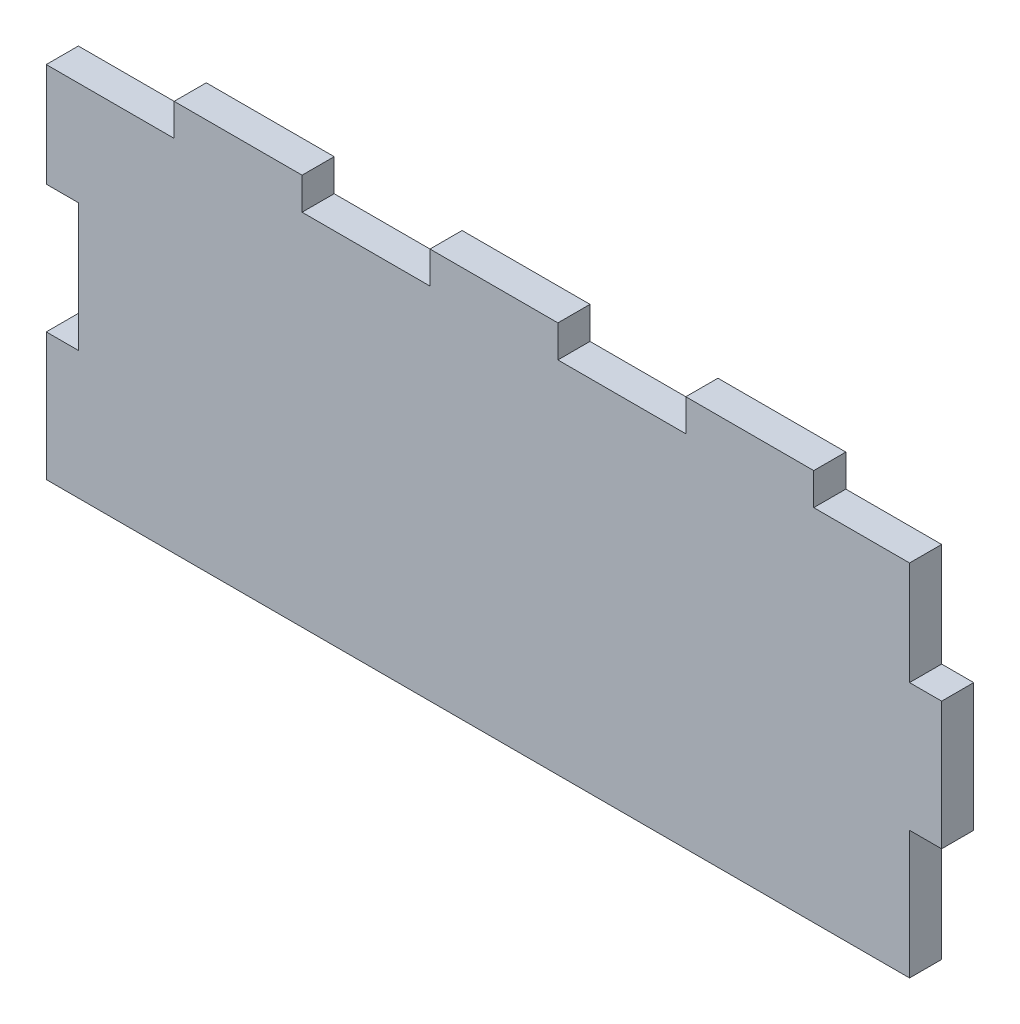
SolidWorks part; units mm, degrees
ref_plane "Front Plane" through (0, 0, 0) normal (0, 0, 1) x (1, 0, 0)
ref_plane "Top Plane" through (0, 0, 0) normal (0, 1, 0) x (1, 0, 0)
ref_plane "Right Plane" through (0, 0, 0) normal (1, 0, 0) x (0, 0, -1)
sketch "Sketch1" plane through (0, 0, 0) normal (0, 0, 1) x (1, 0, 0)
  line L2 (341.4546, 411.4244) -> (852.4546, 411.4244)
  line L14 (341.4546, 487.1387) -> (341.4546, 411.4244)
  line L25 (568.5975, 643.1816) -> (568.5975, 624.1816)
  line L29 (417.1689, 643.1816) -> (417.1689, 624.1816)
  line L38 (341.4546, 562.853) -> (341.4546, 624.1816)
  line L40 (852.4546, 487.1387) -> (871.4546, 487.1387)
  line L43 (341.4546, 562.853) -> (360.4546, 562.853)
  line L44 (871.4546, 562.853) -> (871.4546, 487.1387)
  line L45 (644.3118, 624.1816) -> (720.0261, 624.1816)
  line L46 (720.0261, 643.1816) -> (795.7403, 643.1816)
  line L47 (341.4546, 624.1816) -> (417.1689, 624.1816)
  line L48 (492.8832, 643.1816) -> (492.8832, 624.1816)
  line L49 (417.1689, 643.1816) -> (492.8832, 643.1816)
  line L50 (852.4546, 624.1816) -> (852.4546, 562.853)
  line L51 (852.4546, 487.1387) -> (852.4546, 411.4244)
  line L52 (795.7403, 643.1816) -> (795.7403, 624.1816)
  line L53 (568.5975, 643.1816) -> (644.3118, 643.1816)
  line L54 (492.8832, 624.1816) -> (568.5975, 624.1816)
  line L55 (341.4546, 487.1387) -> (360.4546, 487.1387)
  line L56 (720.0261, 643.1816) -> (720.0261, 624.1816)
  line L57 (360.4546, 562.853) -> (360.4546, 487.1387)
  line L58 (644.3118, 643.1816) -> (644.3118, 624.1816)
  line L59 (852.4546, 562.853) -> (871.4546, 562.853)
  line L60 (795.7403, 624.1816) -> (852.4546, 624.1816)
  dimension "D1" = 19
  dimension "D2" = 530
extrude "Boss-Extrude1" add sketch "Sketch1" along normal blind 19
